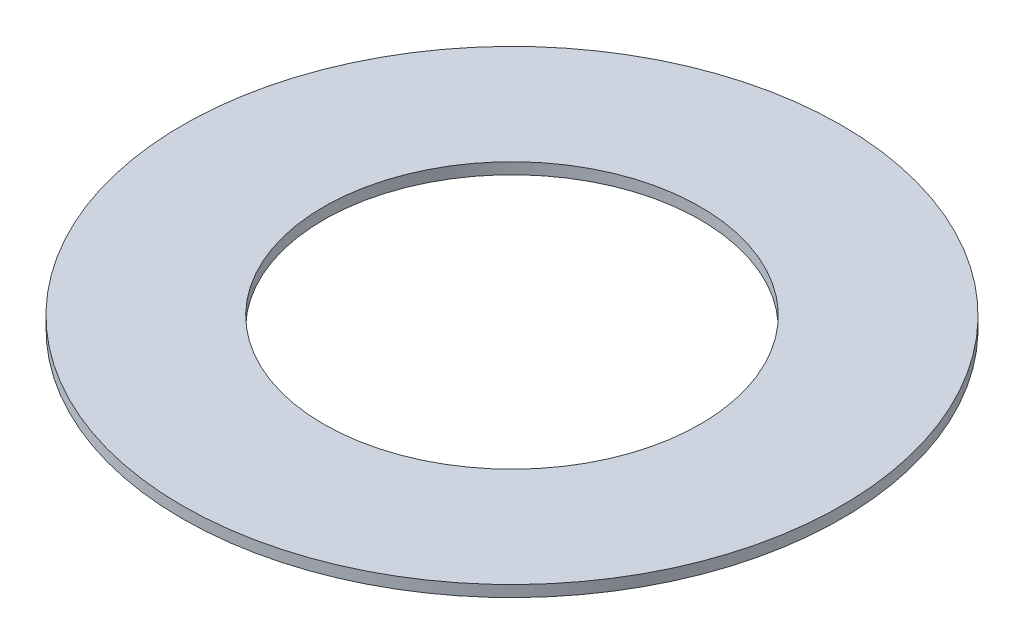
SolidWorks part; units mm, degrees
ref_plane "Front Plane" through (0, 0, 0) normal (0, 0, 1) x (1, 0, 0)
ref_plane "Top Plane" through (0, 0, 0) normal (0, 1, 0) x (1, 0, 0)
ref_plane "Right Plane" through (0, 0, 0) normal (1, 0, 0) x (0, 0, -1)
sketch "Base_Profile" plane through (0, 0, 0) normal (0, 1, 0) x (1, 0, 0)
  circle A0 centre (0, 0) radius 350
  circle A1 centre (0, 0) radius 200
  dimension "Base_Diameter" = 700
  dimension "Base_Thickness" = 150
extrude "Base_Extrude" add sketch "Base_Profile" along normal blind 12
equation "\"Base_Diameter@Base_Profile\" = \"base_diameter@Table.SLDASM\""
equation "\"Base_Thickness@Base_Profile\" = \"base_thickness@Table.SLDASM\""
equation "\"D1@Base_Extrude\" = \"material_thickness@Table.SLDASM\""
